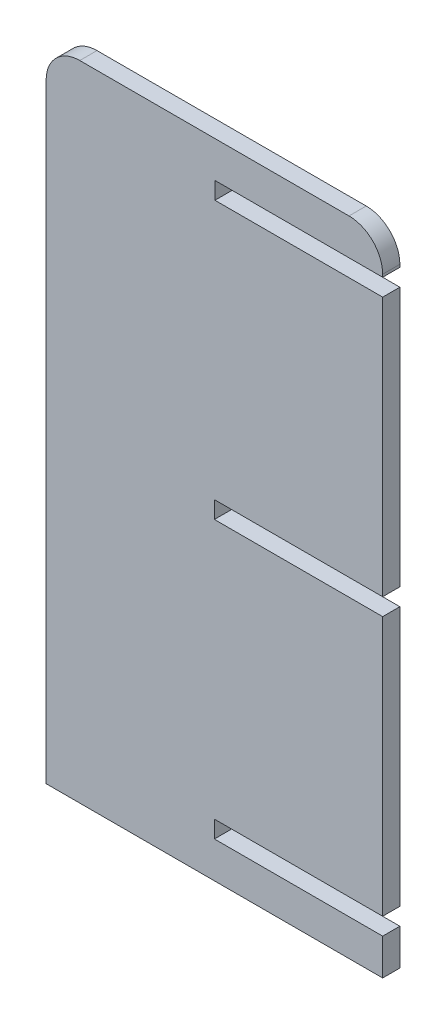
SolidWorks part; units mm, degrees
ref_plane "Alzado" through (0, 0, 0) normal (0, 0, 1) x (1, 0, 0)
ref_plane "Planta" through (0, 0, 0) normal (0, 1, 0) x (1, 0, 0)
ref_plane "Vista lateral" through (0, 0, 0) normal (1, 0, 0) x (0, 0, -1)
sketch "Croquis1" plane through (0, 0, 0) normal (0, 0, 1) x (1, 0, 0)
  line L0 (-222.6705, -629.7924) -> (227.3295, -629.7924)
  line L3 (-222.6705, 185.2076) -> (-222.6705, -629.7924)
  line L4 (227.3295, -629.7924) -> (227.3295, -581.2924)
  line L6 (2.3295, -581.2924) -> (2.3295, -558.2924)
  line L8 (227.3295, -558.2924) -> (227.3295, -211.2924)
  line L10 (2.3295, -211.2924) -> (2.3295, -188.2924)
  line L12 (227.3295, -188.2924) -> (227.3295, 158.7076)
  line L14 (3.032, 158.7076) -> (3.032, 181.7076)
  line L16 (227.3295, 181.7076) -> (227.3295, 185.2076)
  line L17 (182.3295, 230.2076) -> (-177.6705, 230.2076)
  line L22 (3.032, 181.7076) -> (227.3295, 181.7076)
  line L23 (227.3295, 158.7076) -> (3.032, 158.7076)
  line L24 (2.3295, -188.2924) -> (227.3295, -188.2924)
  line L25 (227.3295, -211.2924) -> (2.3295, -211.2924)
  line L26 (2.3295, -558.2924) -> (227.3295, -558.2924)
  line L27 (227.3295, -581.2924) -> (2.3295, -581.2924)
  arc A0 (-177.6705, 230.2076) -> (-222.6705, 185.2076) centre (-177.6705, 185.2076) ccw
  arc A1 (227.3295, 185.2076) -> (182.3295, 230.2076) centre (182.3295, 185.2076) ccw
  point P20 (227.3295, 230.2076)
  dimension "D13" = 45
  dimension "D14" = 45
  dimension "D1" = 450
extrude "Saliente-Extruir1" add sketch "Croquis1" along normal blind 23
